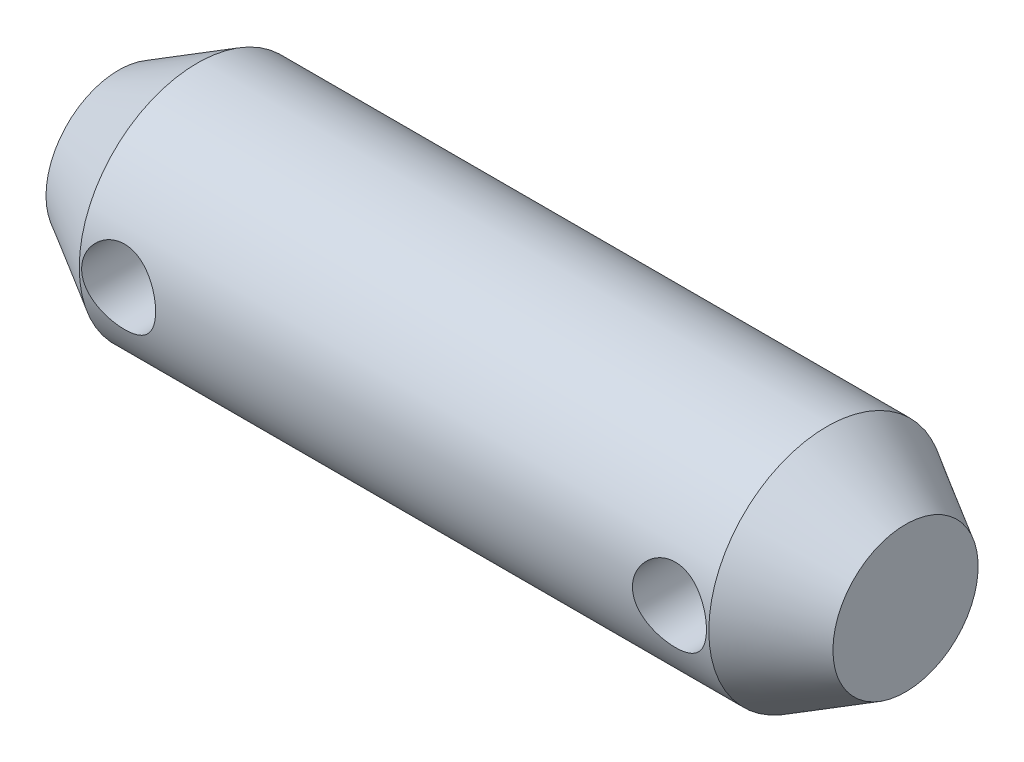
SolidWorks part; units mm, degrees
ref_plane "Front" through (0, 0, 0) normal (0, 0, 1) x (1, 0, 0)
ref_plane "Top" through (0, 0, 0) normal (0, 1, 0) x (1, 0, 0)
ref_plane "Right" through (0, 0, 0) normal (1, 0, 0) x (0, 0, -1)
sketch "Sketch1" plane through (0, 0, 0) normal (0, 0, 1) x (1, 0, 0)
  line L0 (10, 0) -> (10, 0.9226)
  line L1 (10, 0.9226) -> (9, 1.5)
  line L2 (9, 1.5) -> (1, 1.5)
  line L3 (1, 1.5) -> (0, 0.9226)
  line L4 (0, 0.9226) -> (0, 0)
  line L5 (0, 0) -> (10, 0)
  line L6 (-13.7358, 0) -> (5.379, 0) construction
  dimension "l" = 10
  dimension "d" = 3
  dimension "D3" = 30
  dimension "D4" = 30
  dimension "c" = 1
  dimension "c1" = 1
revolve "Base-Revolve" add sketch "Sketch1" angle 360 about L6
sketch "Sketch2" plane through (0, 0, 0) normal (0, 0, 1) x (1, 0, 0)
  line L2 (0, 0.9226) -> (0, -0.9226) construction
  circle A0 centre (8.5, 0) radius 0.47
  circle A1 centre (1.5, 0) radius 0.47
  dimension "d1" = 0.94
  dimension "le" = 1.5
  dimension "lh" = 7
extrude "Hole" cut sketch "Sketch2" against normal through all and the other way through all
equation "\"c1@Sketch1\" = \"c@Sketch1\""
